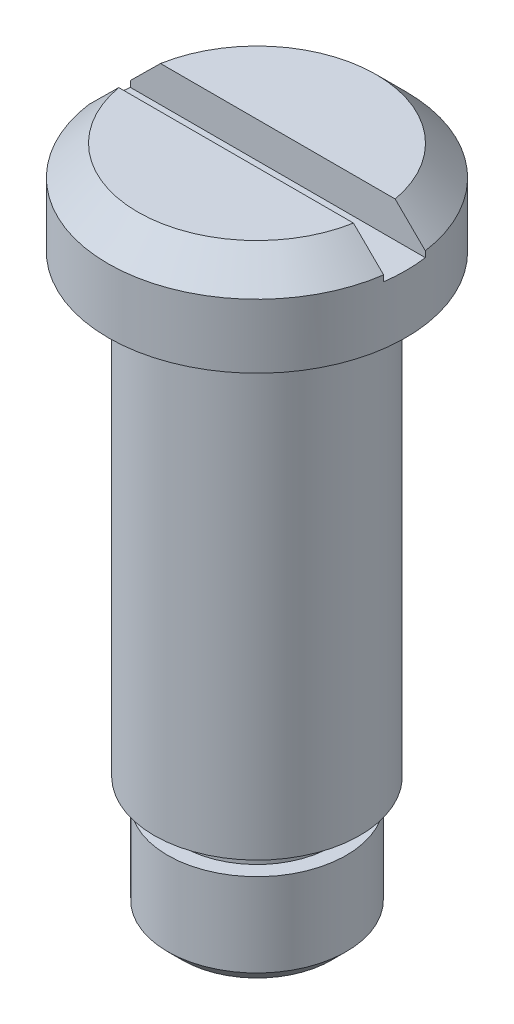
SolidWorks part; units mm, degrees
ref_plane "Plan1" through (0, 0, 0) normal (0, 0, 1) x (1, 0, 0)
ref_plane "Plan2" through (0, 0, 0) normal (0, 1, 0) x (1, 0, 0)
ref_plane "Plan3" through (0, 0, 0) normal (1, 0, 0) x (0, 0, -1)
sketch "Esquisse1" plane through (0, 0, 0) normal (0, 0, 1) x (1, 0, 0)
  line L0 (0, 40) -> (0, -30) construction
  line L1 (0, 0) -> (-2.5, 0)
  line L2 (-2.5, 0) -> (-3, 0.5)
  line L3 (-3, 0.5) -> (-3, 3.3)
  line L4 (-3, 3.3) -> (-2.5, 3.3)
  line L5 (-2.5, 3.3) -> (-2.5, 4.1)
  line L6 (-2.5, 4.1) -> (-3.45, 4.1)
  line L7 (-3.45, 4.1) -> (-3.45, 19.35)
  line L8 (-3.45, 19.35) -> (-5, 19.35)
  line L9 (-5, 19.35) -> (-5, 21.5)
  line L10 (-5, 21.5) -> (-4, 22.5)
  line L11 (-4, 22.5) -> (0, 22.5)
  line L12 (0, 22.5) -> (0, 0)
  dimension "D1" = 5
  dimension "D2" = 6
  dimension "D3" = 0.5
  dimension "D4" = 5
  dimension "D5" = 6.9
  dimension "D6" = 10
  dimension "D7" = 8
  dimension "D8" = 1
  dimension "D9" = 2.8
  dimension "D10" = 0.8
  dimension "D11" = 15.25
  dimension "D12" = 2.15
revolve "Base-Révolution" add sketch "Esquisse1" angle 360 about L0
sketch "Esquisse2" plane through (0, 22.5, 0) normal (0, 1, 0) x (-1, 0, 0)
  line L0 (-10, 0) -> (10, 0) construction
  line L1 (0, -10) -> (0, 10) construction
  line L2 (-7.5, -0.7) -> (7.5, -0.7)
  line L3 (-7.5, -0.7) -> (-7.5, 0.7)
  line L4 (-7.5, 0.7) -> (7.5, 0.7)
  line L5 (7.5, -0.7) -> (7.5, 0.7)
  dimension "D1" = 1.4
  dimension "D2" = 15
extrude "Enlèv. mat.-Extru.1" cut sketch "Esquisse2" against normal blind 1.2
